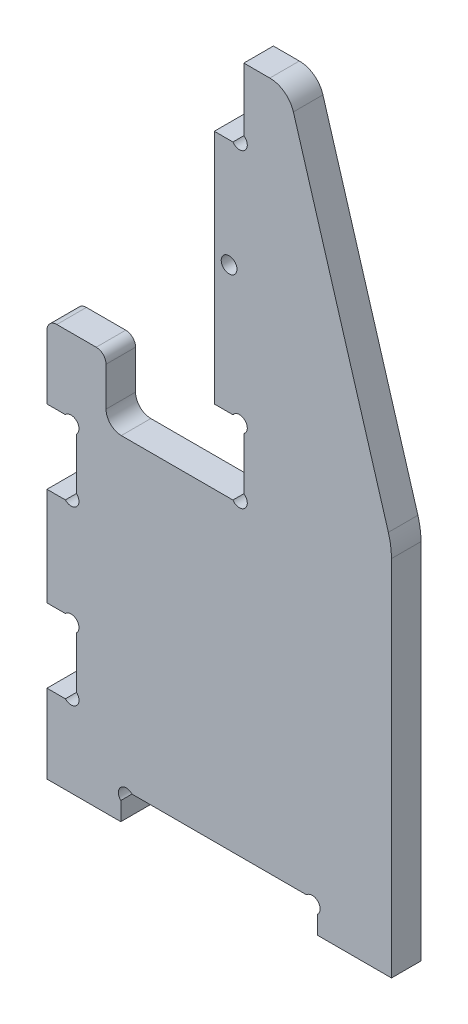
SolidWorks part; units mm, degrees
ref_plane "Plan de face" through (0, 0, 0) normal (0, 0, 1) x (1, 0, 0)
ref_plane "Plan de dessus" through (0, 0, 0) normal (0, 1, 0) x (1, 0, 0)
ref_plane "Plan de droite" through (0, 0, 0) normal (1, 0, 0) x (0, 0, -1)
sketch "Esquisse1" plane through (0, 0, 0) normal (0, 0, 1) x (1, 0, 0)
  line L0 (-23.4749, 0) -> (70.7237, 0) construction
  line L1 (-70, -70) -> (61.6029, -70) construction
  line L2 (-15, 4.1866) -> (-15, -81.0533) construction
  line L3 (0, 5) -> (0, -8) construction
  line L4 (19, 73.8637) -> (19, -85.8392) construction
  line L5 (-4.6352, -8) -> (29.7548, -8) construction
  line L6 (7.9246, 70) -> (77.1532, 70) construction
  line L7 (55, 73.8637) -> (55, -81.0533) construction
  line L8 (34, 73.8637) -> (34, 59.6643) construction
  line L9 (-57.8785, -76) -> (75.7796, -76) construction
  line L10 (40, -60.2425) -> (40, -82.812) construction
  line L11 (0, -62.2943) -> (0, -82.812) construction
  line L12 (-13, 5) -> (-5, 5)
  line L13 (0.1, -8) -> (19, -8)
  line L15 (19, -70) -> (25, -70)
  line L16 (25, 70) -> (30.2798, 70)
  line L17 (35.069, 66.4367) -> (54.3674, 2.1087)
  line L18 (55, -2.2015) -> (55, -76)
  line L19 (55, -76) -> (40, -76)
  line L20 (40, -76) -> (40, -72.2619)
  line L21 (37.7381, -70) -> (25, -70)
  line L22 (0, -72.2619) -> (0, -76)
  line L23 (0, -76) -> (-15, -76)
  line L24 (-15, -76) -> (-15, -60)
  line L25 (25, 71.9337) -> (25, -94.7029) construction
  line L26 (4.5129, 55) -> (65.0389, 55) construction
  line L27 (13.6298, 7) -> (36.6752, 7) construction
  line L28 (10.0843, -55) -> (29.7548, -55) construction
  line L29 (25, 70) -> (25, 57.2229)
  line L30 (22.7771, 55) -> (19, 55)
  line L31 (19, 7) -> (22.7771, 7)
  line L32 (25, 4.7771) -> (25, -5.7771)
  line L33 (22.7771, -8) -> (19, -8)
  line L34 (22, -24.6083) -> (22, -57.0043) construction
  line L35 (1.1753, -40) -> (40, -40) construction
  line L36 (-42.6948, 5) -> (4.5129, 5) construction
  line L37 (19, -70) -> (2.2619, -70)
  line L38 (19, 7) -> (19, 55)
  line L39 (-61.1228, -60) -> (-6.4744, -60) construction
  line L40 (-52.3859, -45) -> (-4.6352, -45) construction
  line L41 (-46.0474, -10) -> (-6.4744, -10) construction
  line L42 (-47.2466, -25) -> (-6.4744, -25) construction
  line L43 (-9, -4.5185) -> (-9, -64.4776) construction
  line L44 (-15, -10) -> (-11.2619, -10)
  line L45 (-9, -12.2619) -> (-9, -22.7381)
  line L46 (-11.2619, -25) -> (-15, -25)
  line L47 (-15, -45) -> (-11.2619, -45)
  line L48 (-9, -47.2619) -> (-9, -57.7381)
  line L49 (-11.2619, -60) -> (-15, -60)
  line L50 (-15, -10) -> (-15, 3)
  line L51 (-15, -45) -> (-15, -25)
  line L52 (-3, 12.9721) -> (-3, -14.2902) construction
  line L53 (-3, -4.9) -> (-3, 3)
  arc A0 (22.7771, 55) -> (25, 57.2229) centre (24.1, 55.9) ccw
  arc A1 (25, 4.7771) -> (22.7771, 7) centre (24.1, 6.1) ccw
  arc A2 (22.7771, -8) -> (25, -5.7771) centre (24.1, -7.1) ccw
  circle A3 centre (22, -40) radius 1.6 construction
  arc A4 (-15, 3) -> (-13, 5) centre (-13, 3) cw
  arc A5 (-5, 5) -> (-3, 3) centre (-5, 3) cw
  arc A6 (30.2798, 70) -> (35.069, 66.4367) centre (30.2798, 65) cw
  arc A7 (54.3674, 2.1087) -> (55, -2.2015) centre (40, -2.2015) cw
  circle A8 centre (22, 33) radius 1.6
  arc A9 (-9, -12.2619) -> (-11.2619, -10) centre (-10.1, -11.1) ccw
  arc A10 (-11.2619, -25) -> (-9, -22.7381) centre (-10.1, -23.9) ccw
  arc A11 (-9, -47.2619) -> (-11.2619, -45) centre (-10.1, -46.1) ccw
  arc A12 (-11.2619, -60) -> (-9, -57.7381) centre (-10.1, -58.9) ccw
  arc A13 (2.2619, -70) -> (0, -72.2619) centre (1.1, -71.1) ccw
  arc A14 (40, -72.2619) -> (37.7381, -70) centre (38.9, -71.1) ccw
  arc A15 (0.1, -8) -> (-3, -4.9) centre (0.1, -4.9) cw
  point P64 (-15, 5)
  point P66 (-15, 0)
  point P69 (0, 0)
  point P72 (34, 70)
  point P75 (55, 0)
  point P114 (-3, 5)
  point P117 (-3, -8)
  dimension "D5" = 0.9
  dimension "D10" = 0.9
  dimension "D12" = 0.9
  dimension "D14" = 2
  dimension "D15" = 5
  dimension "D16" = 15
  dimension "D17" = 22
  dimension "D24" = 1.1
  dimension "D26" = 1.1
  dimension "D29" = 1.1
  dimension "D31" = 1.1
  dimension "D33" = 2
  dimension "D34" = 3.1
  dimension "D1" = 15
  dimension "D2" = 6
  dimension "D3" = 15
  dimension "D4" = 15
  dimension "D6" = 15
  dimension "D7" = 15
  dimension "D8" = 15
  dimension "D9" = 0.9
  dimension "D11" = 0.9
  dimension "D13" = 0.9
  dimension "D18" = 5
  dimension "D19" = 10
  dimension "D20" = 15
  dimension "D21" = 10
  dimension "D22" = 15
  dimension "D23" = 6
  dimension "D25" = 1.1
  dimension "D27" = 1.1
  dimension "D28" = 1.1
  dimension "D30" = 1.1
  dimension "D32" = 12
extrude "Extrusion1" add sketch "Esquisse1" against normal blind 6
